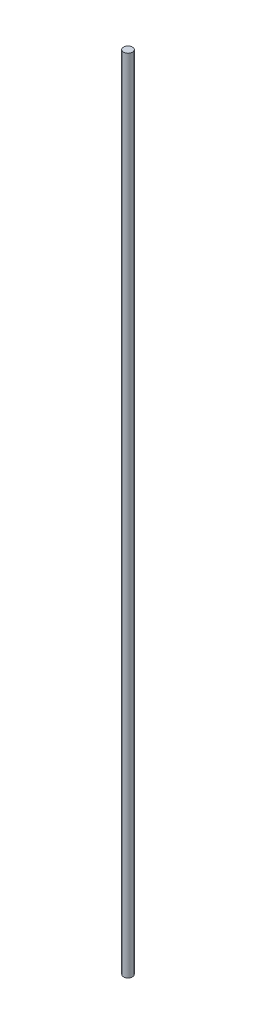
SolidWorks part; units mm, degrees
ref_plane "Front Plane" through (0, 0, 0) normal (0, 0, 1) x (1, 0, 0)
ref_plane "Top Plane" through (0, 0, 0) normal (0, 1, 0) x (1, 0, 0)
ref_plane "Right Plane" through (0, 0, 0) normal (1, 0, 0) x (0, 0, -1)
sketch "Sketch1" plane through (0, 0, 0) normal (0, 1, 0) x (1, 0, 0)
  circle A0 centre (0, 0) radius 6.35
  dimension "D1" = 12.7
extrude "Boss-Extrude1" add sketch "Sketch1" along normal mid plane 1143 contours A0
